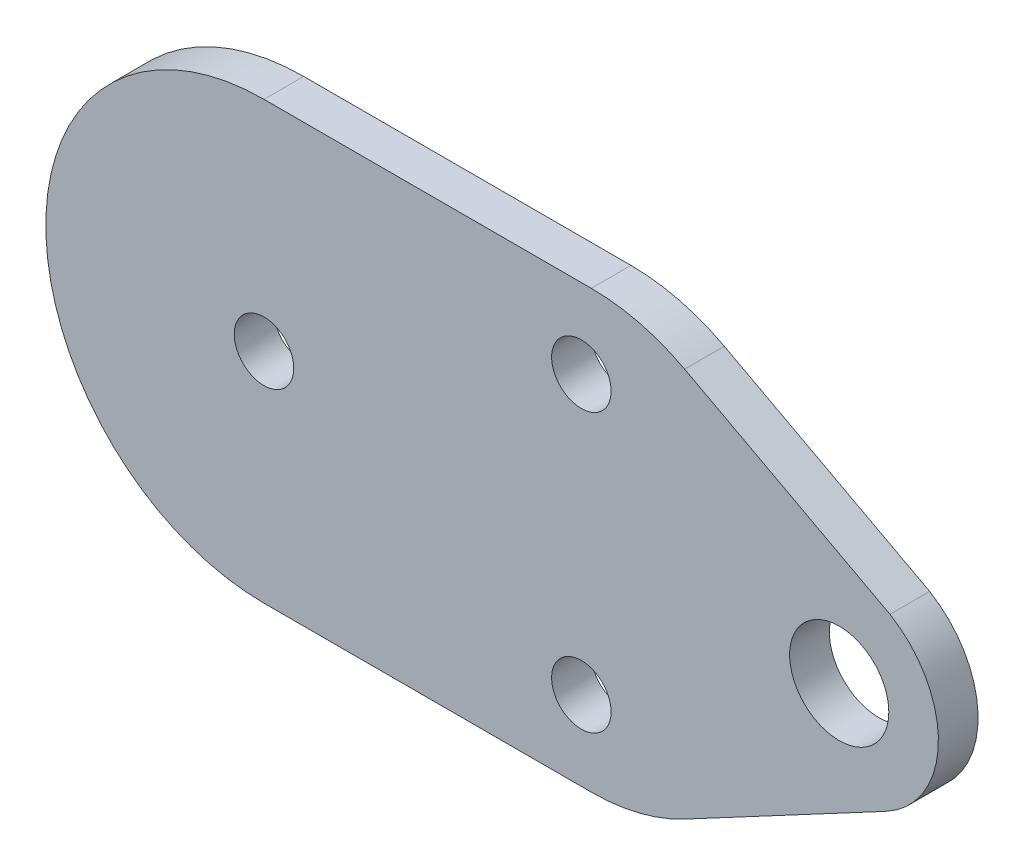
SolidWorks part; units mm, degrees
ref_plane "Plan de face" through (0, 0, 0) normal (0, 0, 1) x (1, 0, 0)
ref_plane "Plan de dessus" through (0, 0, 0) normal (0, 1, 0) x (1, 0, 0)
ref_plane "Plan de droite" through (0, 0, 0) normal (1, 0, 0) x (0, 0, -1)
sketch "Esquisse1" plane through (0, 0, 0) normal (0, 0, 1) x (1, 0, 0)
  line L0 (0, 11) -> (19, 11)
  line L2 (0, -11) -> (19, -11)
  line L3 (0, 0) -> (37.5404, 0) construction
  line L4 (19, 11) -> (31.5585, 4.2958)
  line L5 (19, -11) -> (31.3529, -4.4118)
  circle A0 centre (16, 7) radius 1.5
  circle A1 centre (0, 0) radius 1.5
  arc A3 (31.3529, -4.4118) -> (31.5585, 4.2958) centre (29, 0) ccw
  arc A4 (0, -11) -> (0, 11) centre (0, 0) cw
  circle A5 centre (16, -7) radius 1.5
  circle A6 centre (29, 0) radius 2.5
  dimension "D1" = 3
  dimension "D2" = 3
  dimension "D4" = 11
  dimension "D7" = 5
  dimension "D9" = 11
  dimension "D3" = 5
  dimension "D5" = 19
  dimension "D6" = 19
  dimension "D8" = 29
extrude "Extrusion1" add sketch "Esquisse1" along normal blind 2
fillet "Congé1" radius 10 2 edges at (19, -11, 1) (19, 11, 1)
